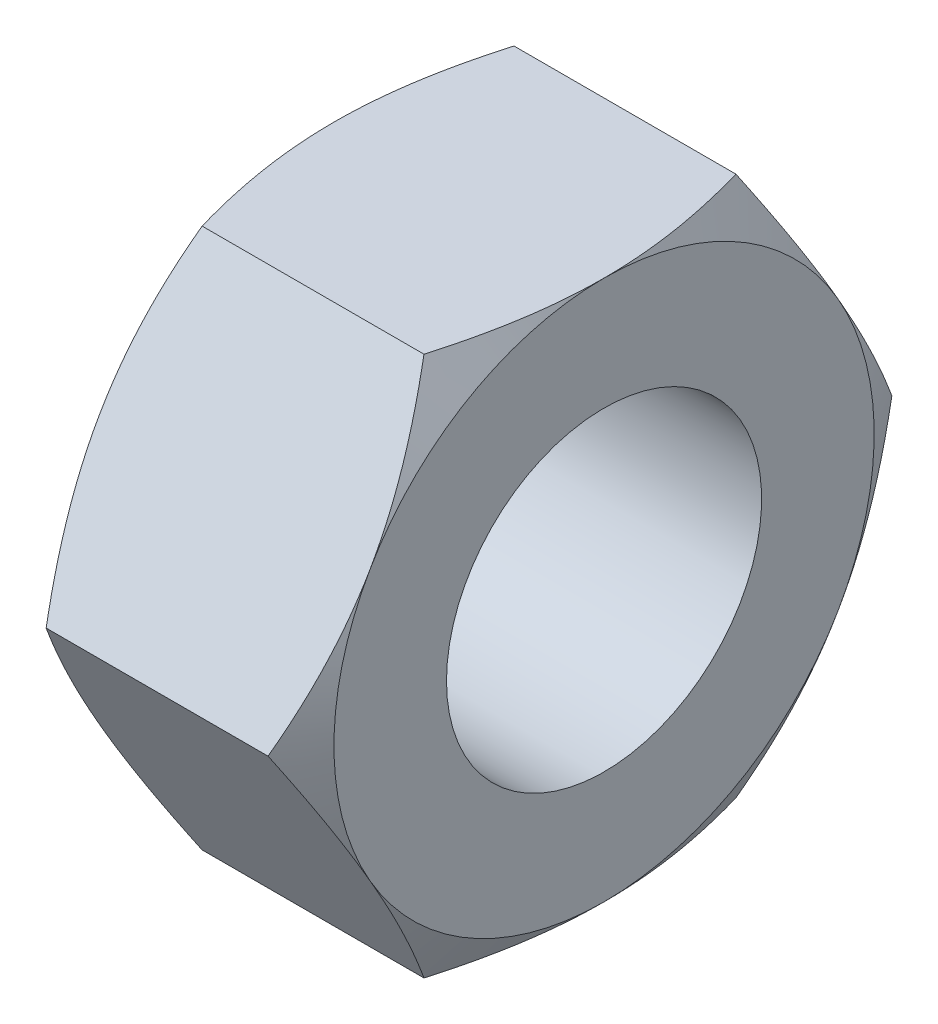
SolidWorks part; units mm, degrees
ref_plane "Plan1" through (0, 0, 0) normal (0, 0, 1) x (1, 0, 0)
ref_plane "Plan2" through (0, 0, 0) normal (0, 1, 0) x (1, 0, 0)
ref_plane "Plan3" through (0, 0, 0) normal (1, 0, 0) x (0, 0, -1)
sketch "Contour" plane through (0, 0, 0) normal (0, 0, 1) x (1, 0, 0)
  line L0 (-30, 0) -> (100, 0) construction
  line L1 (0, 7) -> (-12, 7)
  line L2 (0, 12) -> (-1.072, 13.8568)
  line L3 (0, 7) -> (0, 12)
  line L4 (-1.072, 13.8568) -> (-10.928, 13.8568)
  line L5 (-12, 12) -> (-12, 7)
  line L7 (-10.928, 13.8568) -> (-12, 12)
  dimension "D2" = 60
  dimension "d" = 14
  dimension "k" = 12
  dimension "D1" = 60
  dimension "s" = 24
  dimension "Dt" = 27.7136
revolve "Base-Révolution" add sketch "Contour" angle 360 about L0
sketch "H" plane through (-12, 0, 0) normal (-1, 0, 0) x (0, 0, 1)
  line L1 (13.8564, 0) -> (6.9282, 12)
  line L2 (6.9282, 12) -> (-6.9282, 12)
  line L3 (-6.9282, 12) -> (-13.8564, 0)
  line L4 (-13.8564, 0) -> (-6.9282, -12)
  line L5 (-6.9282, -12) -> (6.9282, -12)
  line L6 (6.9282, -12) -> (13.8564, 0)
  circle A0 centre (0, 0) radius 12 construction
  dimension "s1" = 24
extrude "Hexagone" cut sketch "H" against normal through all flip side to cut
equation "\"s1@H\" = \"s@Contour\""
equation "\"Dt@Contour\" = \"s@Contour\"/0.866"
